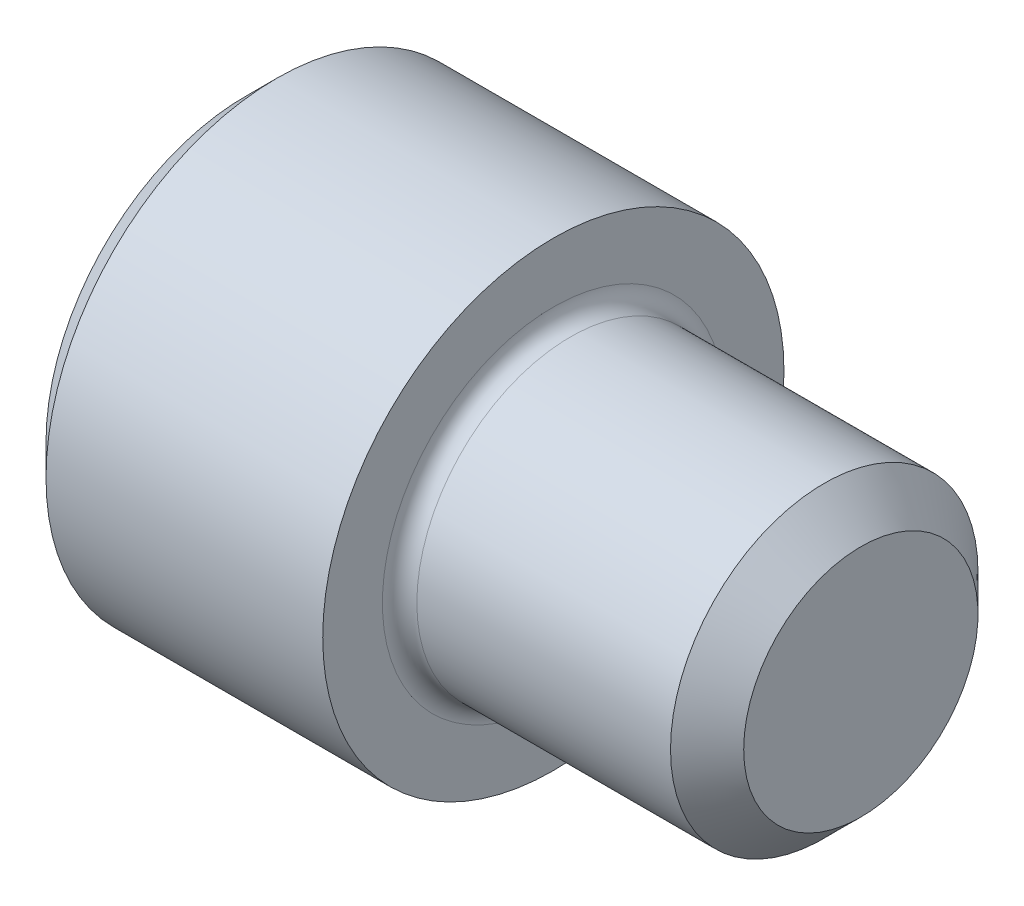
SolidWorks part; units mm, degrees
ref_plane "Plane1" through (0, 0, 0) normal (0, 0, 1) x (1, 0, 0)
ref_plane "Plane2" through (0, 0, 0) normal (0, 1, 0) x (1, 0, 0)
ref_plane "Plane3" through (0, 0, 0) normal (1, 0, 0) x (0, 0, -1)
revolve "Base-Revolve" add sketch "BodySke"
sketch "BodySke"
  dimension "Diameter" = 6.35
  dimension "Head_ht" = 6.35
  dimension "Length" = 6.35
  dimension "Body_ch_ang" = 45
  dimension "Head_dia" = 9.525
  dimension "Head_ch_ang" = 45
  dimension "Head_side_ht" = 5.715
  dimension "Minor_dia" = 4.8387
  dimension "Advance" = 1.27
  dimension "Thread_nom" = 6.35
  dimension "Thread_length" = 38.1
fillet "Fillet1" radius 0.3556 1 edges at (6.35, 0, 3.175)
sketch "Sketch2"
  dimension "D1" = 2.3812
  dimension "D2" = 60
  dimension "Wall_thickness" = 3.302
revolve "Hex-PreBroach" cut sketch "Sketch2" angle 360 about L6
sketch "Sketch3"
  dimension "D1" = 2.3812
  dimension "D2" = 2.3812
  dimension "Hex_size" = 4.7625
extrude "Hex" cut sketch "Sketch3" against normal blind 3.048
sketch "Sketch4"
  dimension "D1" = 30
  dimension "Spline_n_dim" = 4.826
  dimension "Spline_m_dim" = 5.6134
  dimension "D2" = 60
  dimension "D3" = 0.635
  dimension "Spline_p_dim" = 1.27
extrude "Spline" [suppressed] cut sketch "Sketch4" against normal blind 3.048
pattern_circular "CirPattern1" [suppressed] count 6 every 60
sketch "Sketch5"
  dimension "Drilled_hole_dia" = 1.1811
  dimension "Drilled_hole_loc" = 2.159
extrude "Hole" [suppressed] cut sketch "Sketch5" against normal through all and the other way through all
pattern_circular "Drilled-4" [suppressed] count 2 every 60
pattern_circular "Drilled-6" [suppressed] count 3 every 60
sketch "ThdSchSke"
  dimension "Thread_minor" = 4.8387
  dimension "Diameter" = 6.35
  dimension "Start" = 7.62
  dimension "SideAngle" = 55
  dimension "VeeAngle" = 70
  dimension "Overcut" = 7.9375
revolve "ThreadSchematic" [suppressed] cut sketch "ThdSchSke" angle 360 about L3
pattern_linear "ThdSchPat" [suppressed]
equation "\"D2@Sketch3\" = \"Hex_size@Sketch3\" / 2"
equation "\"D1@Sketch3\" = \"Hex_size@Sketch3\" / 2"
equation "\"D1@Sketch2\" = \"Hex_size@Sketch3\" / 2"
equation "\"D3@Sketch4\" = \"Spline_p_dim@Sketch4\" / 2"
equation "\"Thread_minor@ThreadCosmetic\"  =  \"Minor_dia@BodySke\""
equation "\"D2@CirPattern1\" = 360 / \"Num_teeth@CirPattern1\""
equation "\"Wall_thickness@Sketch2\" = \"Head_ht@BodySke\" - \"Key_eng@Hex\""
equation "\"Thread_length@ThreadCosmetic\" = ((sgn( (\"Length@BodySke\" - \"Advance@BodySke\" ) - \"Thread_nom@BodySke\" )-1)*( (\"Length@BodySke\" - \"Advance@BodySke\" ) - \"Thread_nom@BodySke\" ))/-2+ \"Thread_nom@BodySke\""
equation "\"Thread_minor@ThdSchSke\" = \"Minor_dia@BodySke\""
equation "\"Diameter@ThdSchSke\" = \"Diameter@BodySke\""
equation "\"Overcut@ThdSchSke\" = \"Diameter@BodySke\" * 1.25"
equation "\"Start@ThdSchSke\" = \"Head_ht@BodySke\" + \"Length@BodySke\" - \"Thread_length@ThreadCosmetic\"  '---Non-countersunk---"
equation "\"Num_threads@ThdSchPat\" = int( \"Thread_length@ThreadCosmetic\" / \"Advance@BodySke\" + 0.999 )  + 1"
equation "\"Advance@ThdSchPat\" = \"Thread_length@ThreadCosmetic\" /  (\"Num_threads@ThdSchPat\" - 1) 'relax it"
equation "\"Num_threads@ThdSchPat\" = \"Num_threads@ThdSchPat\" - sgn( \"Num_threads@ThdSchPat\" - 1) '---chamfered tips only---"
